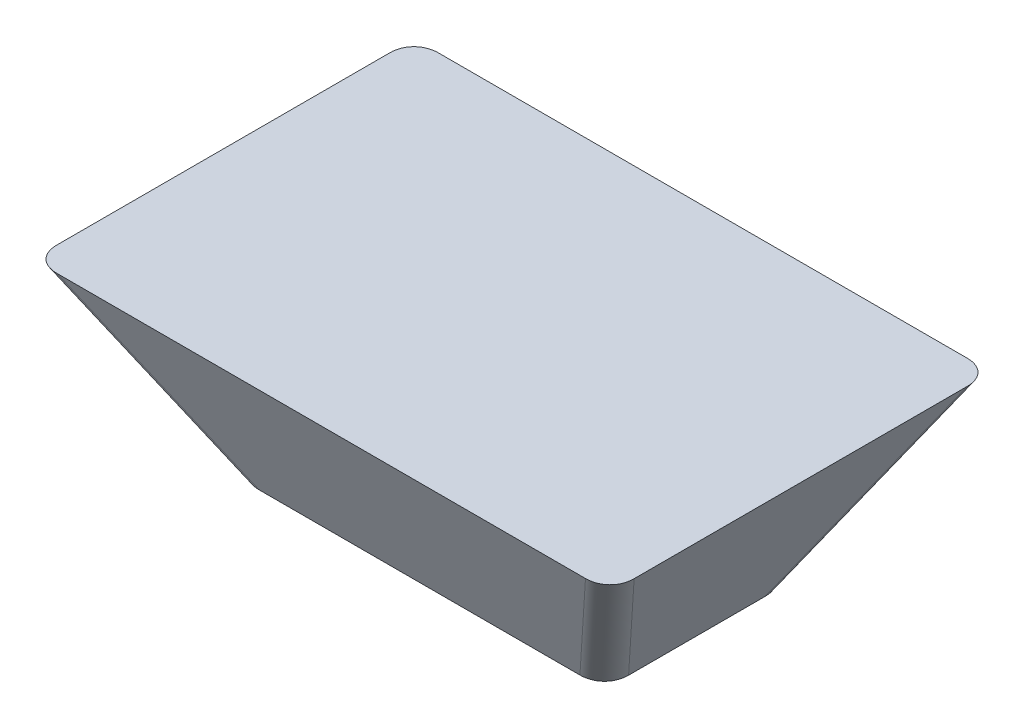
SolidWorks part; units mm, degrees
ref_plane "Front Plane" through (0, 0, 0) normal (0, 0, 1) x (1, 0, 0)
ref_plane "Top Plane" through (0, 0, 0) normal (0, 1, 0) x (1, 0, 0)
ref_plane "Right Plane" through (0, 0, 0) normal (1, 0, 0) x (0, 0, -1)
sketch "Sketch2" plane through (0, 0, 0) normal (0, 1, 0) x (1, 0, 0)
  line L1 (-50.8, -25.4) -> (50.8, -25.4)
  line L2 (-50.8, -25.4) -> (-50.8, 25.4)
  line L3 (-50.8, 25.4) -> (50.8, 25.4)
  line L4 (50.8, -25.4) -> (50.8, 25.4)
  line L5 (-50.8, -25.4) -> (50.8, 25.4) construction
  line L6 (-50.8, 25.4) -> (50.8, -25.4) construction
  line L7 (-79.375, -52.451) -> (79.375, -52.451)
  line L8 (-79.375, -52.451) -> (-79.375, 52.451)
  line L9 (-79.375, 52.451) -> (79.375, 52.451)
  line L10 (79.375, -52.451) -> (79.375, 52.451)
  line L11 (-79.375, -52.451) -> (79.375, 52.451) construction
  line L12 (-79.375, 52.451) -> (79.375, -52.451) construction
  point P0 (0, 0)
  point P6 (0, 0)
  dimension "D1" = 50.8
  dimension "D2" = 101.6
  dimension "D3" = 158.75
  dimension "D4" = 104.902
ref_plane "Plane1" through (0, 50.8, 0) normal (0, 1, 0) x (1, 0, 0)
sketch "Sketch4" plane through (0, 50.8, 0) normal (0, 1, 0) x (1, 0, 0)
  line L0 (-79.375, -52.451) -> (79.375, -52.451) construction
  line L1 (79.375, -52.451) -> (79.375, 52.451) construction
  line L2 (-79.375, 52.451) -> (79.375, 52.451) construction
  line L3 (-79.375, -52.451) -> (-79.375, 52.451) construction
  line L4 (-79.375, -52.451) -> (79.375, -52.451)
  line L5 (79.375, -52.451) -> (79.375, 52.451)
  line L6 (-79.375, 52.451) -> (79.375, 52.451)
  line L7 (-79.375, -52.451) -> (-79.375, 52.451)
sketch "Sketch5" plane through (0, 0, 0) normal (0, 1, 0) x (1, 0, 0)
  line L0 (50.8, -25.4) -> (50.8, 25.4) construction
  line L1 (-50.8, -25.4) -> (50.8, -25.4) construction
  line L2 (-50.8, 25.4) -> (50.8, 25.4) construction
  line L3 (-50.8, -25.4) -> (-50.8, 25.4) construction
  line L4 (50.8, -25.4) -> (50.8, 25.4)
  line L5 (-50.8, -25.4) -> (50.8, -25.4)
  line L6 (-50.8, 25.4) -> (50.8, 25.4)
  line L7 (-50.8, -25.4) -> (-50.8, 25.4)
loft "Loft1" add profiles "Sketch4", "Sketch5"
fillet "Fillet1" radius 7.62 4 edges
